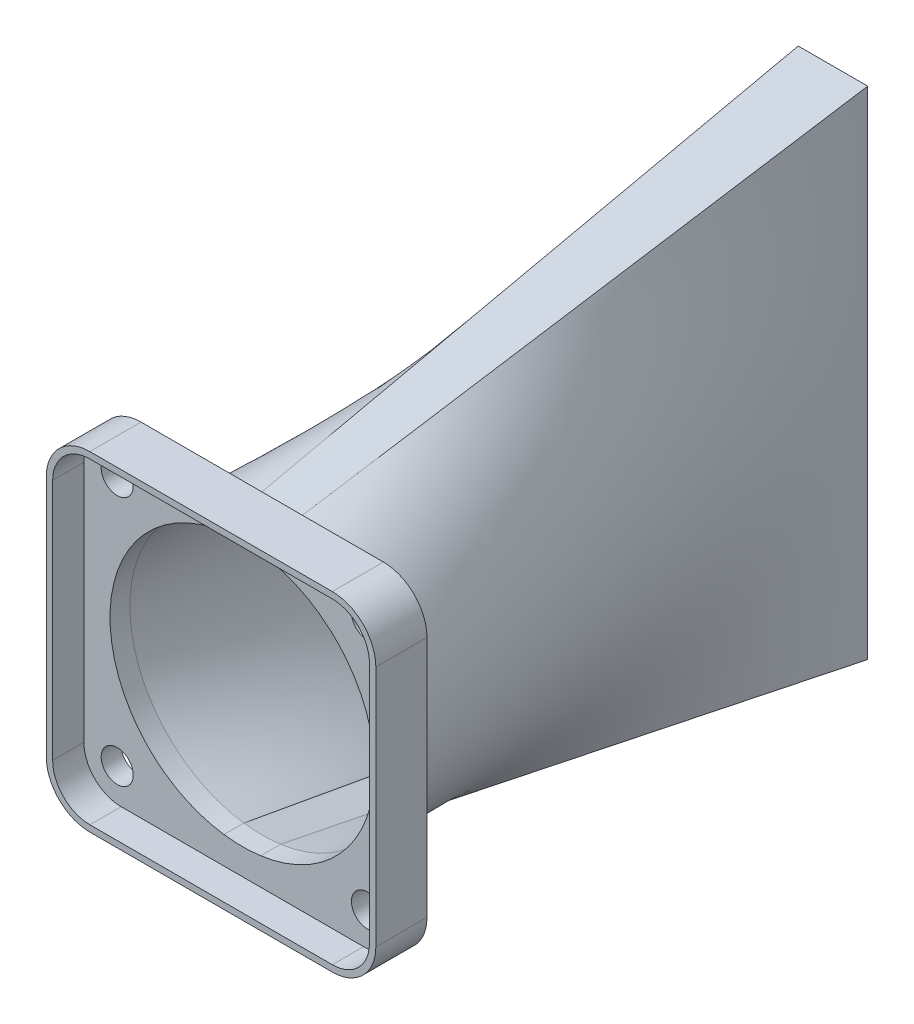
SolidWorks part; units mm, degrees
ref_plane "Front Plane" through (0, 0, 0) normal (0, 0, 1) x (1, 0, 0)
ref_plane "Top Plane" through (0, 0, 0) normal (0, 1, 0) x (1, 0, 0)
ref_plane "Right Plane" through (0, 0, 0) normal (1, 0, 0) x (0, 0, -1)
sketch "Sketch1" plane through (0, 0, 0) normal (0, 0, 1) x (1, 0, 0)
  line L8 (556.6783, -1295.6386) -> (566.1039, -1295.6386)
  line L9 (541.7911, -1271.3258) -> (541.7911, -1280.7514)
  line L10 (566.1039, -1256.4386) -> (556.6783, -1256.4386)
  line L11 (580.9911, -1280.7514) -> (580.9911, -1271.3258)
  line L18 (578.1165, -1263.5558) -> (577.608, -1264.0644)
  line L19 (580.1823, -1267.0666) -> (579.5228, -1267.2289)
  line L28 (581.1911, -1266.0843) -> (580.7911, -1266.0843)
  line L29 (580.7911, -1266.0843) -> (580.7911, -1266.2898)
  line L30 (578.1165, -1263.5558) -> (579.4254, -1262.247)
  line L31 (580.7911, -1262.8126) -> (580.7911, -1263.493)
  line L32 (580.7911, -1263.493) -> (581.1911, -1263.493)
  line L33 (581.1911, -1263.493) -> (581.1911, -1260.5386)
  line L34 (576.8911, -1256.2386) -> (545.8911, -1256.2386)
  line L35 (541.5911, -1260.5386) -> (541.5911, -1291.5386)
  line L36 (545.8911, -1295.8386) -> (576.8911, -1295.8386)
  line L37 (581.1911, -1291.5386) -> (581.1911, -1266.0843)
  arc A4 (547.4411, -1260.0386) -> (543.3411, -1260.0386) centre (545.3911, -1260.0386) ccw
  arc A5 (543.3411, -1260.0386) -> (547.4411, -1260.0386) centre (545.3911, -1260.0386) ccw
  arc A8 (579.4411, -1292.0386) -> (575.3411, -1292.0386) centre (577.3911, -1292.0386) ccw
  arc A9 (575.3411, -1292.0386) -> (579.4411, -1292.0386) centre (577.3911, -1292.0386) ccw
  arc A12 (547.4411, -1292.0386) -> (543.3411, -1292.0386) centre (545.3911, -1292.0386) ccw
  arc A13 (543.3411, -1292.0386) -> (547.4411, -1292.0386) centre (545.3911, -1292.0386) ccw
  arc A28 (579.4411, -1260.0386) -> (575.3411, -1260.0386) centre (577.3911, -1260.0386) ccw
  arc A29 (575.3411, -1260.0386) -> (579.4411, -1260.0386) centre (577.3911, -1260.0386) ccw
  arc A36 (576.8802, -1288.9405) -> (580.9911, -1280.7514) centre (561.3911, -1276.0386) ccw
  arc A37 (576.8802, -1288.9405) -> (574.2929, -1291.5278) centre (577.3911, -1292.0386) ccw
  arc A38 (566.1039, -1295.6386) -> (574.2929, -1291.5278) centre (561.3911, -1276.0386) ccw
  arc A39 (548.4892, -1291.5278) -> (556.6783, -1295.6386) centre (561.3911, -1276.0386) ccw
  arc A40 (548.4892, -1291.5278) -> (545.902, -1288.9405) centre (545.3911, -1292.0386) ccw
  arc A41 (541.7911, -1280.7514) -> (545.902, -1288.9405) centre (561.3911, -1276.0386) ccw
  arc A42 (545.902, -1263.1368) -> (541.7911, -1271.3258) centre (561.3911, -1276.0386) ccw
  arc A43 (545.902, -1263.1368) -> (548.4892, -1260.5495) centre (545.3911, -1260.0386) ccw
  arc A44 (556.6783, -1256.4386) -> (548.4892, -1260.5495) centre (561.3911, -1276.0386) ccw
  arc A45 (574.2929, -1260.5495) -> (566.1039, -1256.4386) centre (561.3911, -1276.0386) ccw
  arc A46 (574.2929, -1260.5495) -> (576.8802, -1263.1368) centre (577.3911, -1260.0386) ccw
  arc A47 (580.9911, -1271.3258) -> (579.5228, -1267.2289) centre (561.3911, -1276.0386) ccw
  arc A49 (577.608, -1264.0644) -> (576.8802, -1263.1368) centre (561.3911, -1276.0386) ccw
  arc A58 (580.1823, -1267.0666) -> (580.7911, -1266.2898) centre (579.9911, -1266.2898) ccw
  arc A62 (580.7911, -1262.8126) -> (579.4254, -1262.247) centre (579.9911, -1262.8126) ccw
  arc A63 (581.1911, -1260.5386) -> (576.8911, -1256.2386) centre (576.8911, -1260.5386) ccw
  arc A64 (545.8911, -1256.2386) -> (541.5911, -1260.5386) centre (545.8911, -1260.5386) ccw
  arc A65 (541.5911, -1291.5386) -> (545.8911, -1295.8386) centre (545.8911, -1291.5386) ccw
  arc A66 (576.8911, -1295.8386) -> (581.1911, -1291.5386) centre (576.8911, -1291.5386) ccw
extrude "Boss-Extrude1" add sketch "Sketch1" along normal blind 2.54
sketch "Sketch2" plane through (0, 0, 2.54) normal (0, 0, 1) x (1, 0, 0)
  line L0 (582.4611, -1291.5386) -> (582.4611, -1264.8143)
  line L1 (582.4611, -1264.8143) -> (579.5211, -1264.8143)
  line L2 (579.5211, -1264.8143) -> (579.5211, -1265.9215)
  line L3 (579.5211, -1265.9215) -> (577.628, -1266.3875)
  line L4 (579.7211, -1271.4788) -> (579.7211, -1280.5984)
  line L5 (565.9509, -1294.3686) -> (556.8313, -1294.3686)
  line L6 (543.0611, -1280.5984) -> (543.0611, -1271.4788)
  line L7 (556.8313, -1257.7086) -> (565.9509, -1257.7086)
  line L8 (577.421, -1266.0474) -> (579.5211, -1263.9473)
  line L9 (579.5211, -1263.9473) -> (579.5211, -1264.763)
  line L10 (579.5211, -1264.763) -> (582.4611, -1264.763)
  line L11 (582.4611, -1264.763) -> (582.4611, -1260.5386)
  line L12 (576.8911, -1254.9686) -> (545.8911, -1254.9686)
  line L13 (540.3211, -1260.5386) -> (540.3211, -1291.5386)
  line L14 (545.8911, -1297.1086) -> (576.8911, -1297.1086)
  line L15 (581.1911, -1291.5386) -> (581.1911, -1266.0843)
  line L16 (581.1911, -1266.0843) -> (580.7911, -1266.0843)
  line L17 (580.7911, -1266.0843) -> (580.7911, -1266.2898)
  line L18 (580.1823, -1267.0666) -> (579.5228, -1267.2289)
  line L19 (580.9911, -1271.3258) -> (580.9911, -1280.7514)
  line L20 (566.1039, -1295.6386) -> (556.6783, -1295.6386)
  line L21 (541.7911, -1280.7514) -> (541.7911, -1271.3258)
  line L22 (556.6783, -1256.4386) -> (566.1039, -1256.4386)
  line L23 (577.608, -1264.0644) -> (579.4254, -1262.247)
  line L24 (580.7911, -1262.8126) -> (580.7911, -1263.493)
  line L25 (580.7911, -1263.493) -> (581.1911, -1263.493)
  line L26 (581.1911, -1263.493) -> (581.1911, -1260.5386)
  line L27 (576.8911, -1256.2386) -> (545.8911, -1256.2386)
  line L28 (541.5911, -1260.5386) -> (541.5911, -1291.5386)
  line L29 (545.8911, -1295.8386) -> (576.8911, -1295.8386)
  line L30 (581.1911, -1291.5386) -> (581.1911, -1266.0843)
  line L31 (581.1911, -1266.0843) -> (580.7911, -1266.0843)
  line L32 (580.7911, -1266.0843) -> (580.7911, -1266.2898)
  line L33 (580.1823, -1267.0666) -> (579.5228, -1267.2289)
  line L34 (580.9911, -1271.3258) -> (580.9911, -1280.7514)
  line L35 (566.1039, -1295.6386) -> (556.6783, -1295.6386)
  line L36 (541.7911, -1280.7514) -> (541.7911, -1271.3258)
  line L37 (556.6783, -1256.4386) -> (566.1039, -1256.4386)
  line L38 (577.608, -1264.0644) -> (579.4254, -1262.247)
  line L39 (580.7911, -1262.8126) -> (580.7911, -1263.493)
  line L40 (580.7911, -1263.493) -> (581.1911, -1263.493)
  line L41 (581.1911, -1263.493) -> (581.1911, -1260.5386)
  line L42 (576.8911, -1256.2386) -> (545.8911, -1256.2386)
  line L43 (541.5911, -1260.5386) -> (541.5911, -1291.5386)
  line L44 (545.8911, -1295.8386) -> (576.8911, -1295.8386)
  line L45 (581.1911, -1266.0843) -> (582.4611, -1266.0843)
  line L46 (581.1911, -1263.493) -> (582.4611, -1263.493)
  arc A0 (579.5211, -1265.9215) -> (579.5211, -1265.9215) centre (579.5211, -1265.9215) ccw
  arc A1 (579.7211, -1271.4788) -> (577.628, -1266.3875) centre (561.3911, -1276.0386) ccw
  arc A2 (576.1704, -1287.8009) -> (579.7211, -1280.5984) centre (561.3911, -1276.0386) ccw
  arc A3 (576.1704, -1287.8009) -> (573.1534, -1290.818) centre (577.3911, -1292.0386) ccw
  arc A4 (565.9509, -1294.3686) -> (573.1534, -1290.818) centre (561.3911, -1276.0386) ccw
  arc A5 (549.6288, -1290.818) -> (556.8313, -1294.3686) centre (561.3911, -1276.0386) ccw
  arc A6 (549.6288, -1290.818) -> (546.6117, -1287.8009) centre (545.3911, -1292.0386) ccw
  arc A7 (543.0611, -1280.5984) -> (546.6117, -1287.8009) centre (561.3911, -1276.0386) ccw
  arc A8 (546.6117, -1264.2763) -> (543.0611, -1271.4788) centre (561.3911, -1276.0386) ccw
  arc A9 (546.6117, -1264.2763) -> (549.6288, -1261.2593) centre (545.3911, -1260.0386) ccw
  arc A10 (556.8313, -1257.7086) -> (549.6288, -1261.2593) centre (561.3911, -1276.0386) ccw
  arc A11 (573.1534, -1261.2593) -> (565.9509, -1257.7086) centre (561.3911, -1276.0386) ccw
  arc A12 (573.1534, -1261.2593) -> (576.1704, -1264.2763) centre (577.3911, -1260.0386) ccw
  arc A13 (577.421, -1266.0474) -> (576.1704, -1264.2763) centre (561.3911, -1276.0386) ccw
  arc A14 (579.5211, -1263.9473) -> (579.5211, -1263.9473) centre (579.5211, -1263.9473) ccw
  arc A15 (582.4611, -1260.5386) -> (576.8911, -1254.9686) centre (576.8911, -1260.5386) ccw
  arc A16 (545.8911, -1254.9686) -> (540.3211, -1260.5386) centre (545.8911, -1260.5386) ccw
  arc A17 (540.3211, -1291.5386) -> (545.8911, -1297.1086) centre (545.8911, -1291.5386) ccw
  arc A18 (576.8911, -1297.1086) -> (582.4611, -1291.5386) centre (576.8911, -1291.5386) ccw
  arc A19 (580.1823, -1267.0666) -> (580.7911, -1266.2898) centre (579.9911, -1266.2898) ccw
  arc A20 (580.9911, -1271.3258) -> (579.5228, -1267.2289) centre (561.3911, -1276.0386) ccw
  arc A21 (576.8802, -1288.9405) -> (580.9911, -1280.7514) centre (561.3911, -1276.0386) ccw
  arc A22 (576.8802, -1288.9405) -> (574.2929, -1291.5278) centre (577.3911, -1292.0386) ccw
  arc A23 (566.1039, -1295.6386) -> (574.2929, -1291.5278) centre (561.3911, -1276.0386) ccw
  arc A24 (548.4892, -1291.5278) -> (556.6783, -1295.6386) centre (561.3911, -1276.0386) ccw
  arc A25 (548.4892, -1291.5278) -> (545.902, -1288.9405) centre (545.3911, -1292.0386) ccw
  arc A26 (541.7911, -1280.7514) -> (545.902, -1288.9405) centre (561.3911, -1276.0386) ccw
  arc A27 (545.902, -1263.1368) -> (541.7911, -1271.3258) centre (561.3911, -1276.0386) ccw
  arc A28 (545.902, -1263.1368) -> (548.4892, -1260.5495) centre (545.3911, -1260.0386) ccw
  arc A29 (556.6783, -1256.4386) -> (548.4892, -1260.5495) centre (561.3911, -1276.0386) ccw
  arc A30 (574.2929, -1260.5495) -> (566.1039, -1256.4386) centre (561.3911, -1276.0386) ccw
  arc A31 (574.2929, -1260.5495) -> (576.8802, -1263.1368) centre (577.3911, -1260.0386) ccw
  arc A32 (577.608, -1264.0644) -> (576.8802, -1263.1368) centre (561.3911, -1276.0386) ccw
  arc A33 (580.7911, -1262.8126) -> (579.4254, -1262.247) centre (579.9911, -1262.8126) ccw
  arc A34 (581.1911, -1260.5386) -> (576.8911, -1256.2386) centre (576.8911, -1260.5386) ccw
  arc A35 (545.8911, -1256.2386) -> (541.5911, -1260.5386) centre (545.8911, -1260.5386) ccw
  arc A36 (541.5911, -1291.5386) -> (545.8911, -1295.8386) centre (545.8911, -1291.5386) ccw
  arc A37 (576.8911, -1295.8386) -> (581.1911, -1291.5386) centre (576.8911, -1291.5386) ccw
  arc A38 (580.1823, -1267.0666) -> (580.7911, -1266.2898) centre (579.9911, -1266.2898) ccw
  arc A39 (580.9911, -1271.3258) -> (579.5228, -1267.2289) centre (561.3911, -1276.0386) ccw
  arc A40 (576.8802, -1288.9405) -> (580.9911, -1280.7514) centre (561.3911, -1276.0386) ccw
  arc A41 (576.8802, -1288.9405) -> (574.2929, -1291.5278) centre (577.3911, -1292.0386) ccw
  arc A42 (566.1039, -1295.6386) -> (574.2929, -1291.5278) centre (561.3911, -1276.0386) ccw
  arc A43 (548.4892, -1291.5278) -> (556.6783, -1295.6386) centre (561.3911, -1276.0386) ccw
  arc A44 (548.4892, -1291.5278) -> (545.902, -1288.9405) centre (545.3911, -1292.0386) ccw
  arc A45 (541.7911, -1280.7514) -> (545.902, -1288.9405) centre (561.3911, -1276.0386) ccw
  arc A46 (545.902, -1263.1368) -> (541.7911, -1271.3258) centre (561.3911, -1276.0386) ccw
  arc A47 (545.902, -1263.1368) -> (548.4892, -1260.5495) centre (545.3911, -1260.0386) ccw
  arc A48 (556.6783, -1256.4386) -> (548.4892, -1260.5495) centre (561.3911, -1276.0386) ccw
  arc A49 (574.2929, -1260.5495) -> (566.1039, -1256.4386) centre (561.3911, -1276.0386) ccw
  arc A50 (574.2929, -1260.5495) -> (576.8802, -1263.1368) centre (577.3911, -1260.0386) ccw
  arc A51 (577.608, -1264.0644) -> (576.8802, -1263.1368) centre (561.3911, -1276.0386) ccw
  arc A52 (580.7911, -1262.8126) -> (579.4254, -1262.247) centre (579.9911, -1262.8126) ccw
  arc A53 (581.1911, -1260.5386) -> (576.8911, -1256.2386) centre (576.8911, -1260.5386) ccw
  arc A54 (545.8911, -1256.2386) -> (541.5911, -1260.5386) centre (545.8911, -1260.5386) ccw
  arc A55 (541.5911, -1291.5386) -> (545.8911, -1295.8386) centre (545.8911, -1291.5386) ccw
  arc A56 (576.8911, -1295.8386) -> (581.1911, -1291.5386) centre (576.8911, -1291.5386) ccw
  dimension "D1" = 0
  dimension "D2" = 1.27
extrude "Boss-Extrude2" add sketch "Sketch2" against normal up to vertex contours L14 A18 L0 L45 L46 L11 A15 L12 A16 L13 A17 M37 M70 M69 M68 M67 M66 M65 M64 M63
sketch "Sketch3" plane through (0, 0, 2.54) normal (0, 0, 1) x (1, 0, 0)
  line L0 (576.8911, -1291.5386) -> (574.2727, -1288.9203)
  line L15 (582.4611, -1291.5386) -> (582.4611, -1266.0843)
  line L16 (582.4611, -1266.0843) -> (580.7911, -1266.0843)
  line L17 (580.7911, -1266.0843) -> (580.7911, -1266.2898)
  line L18 (580.1823, -1267.0666) -> (579.5228, -1267.2289)
  line L19 (580.9911, -1271.3258) -> (580.9911, -1280.7514)
  line L20 (566.1039, -1295.6386) -> (556.6783, -1295.6386)
  line L21 (541.7911, -1280.7514) -> (541.7911, -1271.3258)
  line L22 (556.6783, -1256.4386) -> (566.1039, -1256.4386)
  line L23 (577.608, -1264.0644) -> (579.4254, -1262.247)
  line L24 (580.7911, -1262.8126) -> (580.7911, -1263.493)
  line L25 (580.7911, -1263.493) -> (582.4611, -1263.493)
  line L26 (582.4611, -1263.493) -> (582.4611, -1260.5386)
  line L27 (576.8911, -1254.9686) -> (545.8911, -1254.9686)
  line L28 (540.3211, -1260.5386) -> (540.3211, -1291.5386)
  line L29 (545.8911, -1297.1086) -> (576.8911, -1297.1086)
  line L30 (582.4611, -1291.5386) -> (582.4611, -1266.0843)
  line L31 (582.4611, -1266.0843) -> (580.7911, -1266.0843)
  line L32 (580.7911, -1266.0843) -> (580.7911, -1266.2898)
  line L33 (580.1823, -1267.0666) -> (579.5228, -1267.2289)
  line L34 (580.9911, -1271.3258) -> (580.9911, -1280.7514)
  line L35 (566.1039, -1295.6386) -> (556.6783, -1295.6386)
  line L36 (541.7911, -1280.7514) -> (541.7911, -1271.3258)
  line L37 (556.6783, -1256.4386) -> (566.1039, -1256.4386)
  line L38 (577.608, -1264.0644) -> (579.4254, -1262.247)
  line L39 (580.7911, -1262.8126) -> (580.7911, -1263.493)
  line L40 (580.7911, -1263.493) -> (582.4611, -1263.493)
  line L41 (582.4611, -1263.493) -> (582.4611, -1260.5386)
  line L42 (576.8911, -1254.9686) -> (545.8911, -1254.9686)
  line L43 (540.3211, -1260.5386) -> (540.3211, -1291.5386)
  line L44 (545.8911, -1297.1086) -> (576.8911, -1297.1086)
  arc A0 (574.2929, -1260.5495) -> (576.8802, -1263.1368) centre (577.3911, -1260.0386) ccw construction
  circle A1 centre (545.3911, -1260.0386) radius 2.05
  circle A2 centre (545.3911, -1260.0386) radius 2.05
  circle A3 centre (577.3911, -1292.0386) radius 2.05
  circle A4 centre (577.3911, -1292.0386) radius 2.05
  circle A5 centre (545.3911, -1292.0386) radius 2.05
  circle A6 centre (545.3911, -1292.0386) radius 2.05
  circle A7 centre (577.3911, -1260.0386) radius 2.05
  circle A8 centre (577.3911, -1260.0386) radius 2.05
  arc A9 (545.902, -1263.1368) -> (548.4892, -1260.5495) centre (545.3911, -1260.0386) ccw construction
  arc A10 (548.4892, -1291.5278) -> (545.902, -1288.9405) centre (545.3911, -1292.0386) ccw construction
  arc A11 (576.8802, -1288.9405) -> (574.2929, -1291.5278) centre (577.3911, -1292.0386) ccw construction
  arc A12 (574.2929, -1260.5495) -> (576.8802, -1263.1368) centre (577.3911, -1260.0386) ccw
  arc A13 (545.902, -1263.1368) -> (548.4892, -1260.5495) centre (545.3911, -1260.0386) ccw
  arc A14 (548.4892, -1291.5278) -> (545.902, -1288.9405) centre (545.3911, -1292.0386) ccw
  arc A15 (576.8802, -1288.9405) -> (574.2929, -1291.5278) centre (577.3911, -1292.0386) ccw
  arc A16 (576.6736, -1287.6874) -> (573.0398, -1291.3211) centre (577.3911, -1292.0386) ccw construction
  arc A17 (549.7423, -1291.3211) -> (546.1086, -1287.6874) centre (545.3911, -1292.0386) ccw construction
  arc A18 (546.1086, -1264.3899) -> (549.7423, -1260.7561) centre (545.3911, -1260.0386) ccw construction
  arc A19 (573.0398, -1260.7561) -> (576.6736, -1264.3899) centre (577.3911, -1260.0386) ccw construction
  circle A20 centre (561.3911, -1276.0386) radius 18.2174
  arc A22 (580.9911, -1271.3258) -> (576.8802, -1263.1368) centre (561.3911, -1276.0386) ccw
  arc A39 (580.1823, -1267.0666) -> (580.7911, -1266.2898) centre (579.9911, -1266.2898) ccw
  arc A40 (580.9911, -1271.3258) -> (579.5228, -1267.2289) centre (561.3911, -1276.0386) ccw
  arc A41 (576.8802, -1288.9405) -> (580.9911, -1280.7514) centre (561.3911, -1276.0386) ccw
  arc A42 (576.8802, -1288.9405) -> (574.2929, -1291.5278) centre (577.3911, -1292.0386) ccw
  arc A43 (566.1039, -1295.6386) -> (574.2929, -1291.5278) centre (561.3911, -1276.0386) ccw
  arc A44 (548.4892, -1291.5278) -> (556.6783, -1295.6386) centre (561.3911, -1276.0386) ccw
  arc A45 (548.4892, -1291.5278) -> (545.902, -1288.9405) centre (545.3911, -1292.0386) ccw
  arc A46 (541.7911, -1280.7514) -> (545.902, -1288.9405) centre (561.3911, -1276.0386) ccw
  arc A47 (545.902, -1263.1368) -> (541.7911, -1271.3258) centre (561.3911, -1276.0386) ccw
  arc A48 (545.902, -1263.1368) -> (548.4892, -1260.5495) centre (545.3911, -1260.0386) ccw
  arc A49 (556.6783, -1256.4386) -> (548.4892, -1260.5495) centre (561.3911, -1276.0386) ccw
  arc A50 (574.2929, -1260.5495) -> (566.1039, -1256.4386) centre (561.3911, -1276.0386) ccw
  arc A51 (574.2929, -1260.5495) -> (576.8802, -1263.1368) centre (577.3911, -1260.0386) ccw
  arc A52 (577.608, -1264.0644) -> (576.8802, -1263.1368) centre (561.3911, -1276.0386) ccw
  arc A53 (580.7911, -1262.8126) -> (579.4254, -1262.247) centre (579.9911, -1262.8126) ccw
  arc A54 (582.4611, -1260.5386) -> (576.8911, -1254.9686) centre (576.8911, -1260.5386) ccw
  arc A55 (545.8911, -1254.9686) -> (540.3211, -1260.5386) centre (545.8911, -1260.5386) ccw
  arc A56 (540.3211, -1291.5386) -> (545.8911, -1297.1086) centre (545.8911, -1291.5386) ccw
  arc A57 (576.8911, -1297.1086) -> (582.4611, -1291.5386) centre (576.8911, -1291.5386) ccw
  arc A58 (580.1823, -1267.0666) -> (580.7911, -1266.2898) centre (579.9911, -1266.2898) ccw
  arc A59 (580.9911, -1271.3258) -> (579.5228, -1267.2289) centre (561.3911, -1276.0386) ccw
  arc A60 (576.8802, -1288.9405) -> (580.9911, -1280.7514) centre (561.3911, -1276.0386) ccw
  arc A61 (576.8802, -1288.9405) -> (574.2929, -1291.5278) centre (577.3911, -1292.0386) ccw
  arc A62 (566.1039, -1295.6386) -> (574.2929, -1291.5278) centre (561.3911, -1276.0386) ccw
  arc A63 (548.4892, -1291.5278) -> (556.6783, -1295.6386) centre (561.3911, -1276.0386) ccw
  arc A64 (548.4892, -1291.5278) -> (545.902, -1288.9405) centre (545.3911, -1292.0386) ccw
  arc A65 (541.7911, -1280.7514) -> (545.902, -1288.9405) centre (561.3911, -1276.0386) ccw
  arc A66 (545.902, -1263.1368) -> (541.7911, -1271.3258) centre (561.3911, -1276.0386) ccw
  arc A67 (545.902, -1263.1368) -> (548.4892, -1260.5495) centre (545.3911, -1260.0386) ccw
  arc A68 (556.6783, -1256.4386) -> (548.4892, -1260.5495) centre (561.3911, -1276.0386) ccw
  arc A69 (574.2929, -1260.5495) -> (566.1039, -1256.4386) centre (561.3911, -1276.0386) ccw
  arc A70 (574.2929, -1260.5495) -> (576.8802, -1263.1368) centre (577.3911, -1260.0386) ccw
  arc A71 (577.608, -1264.0644) -> (576.8802, -1263.1368) centre (561.3911, -1276.0386) ccw
  arc A72 (580.7911, -1262.8126) -> (579.4254, -1262.247) centre (579.9911, -1262.8126) ccw
  arc A73 (582.4611, -1260.5386) -> (576.8911, -1254.9686) centre (576.8911, -1260.5386) ccw
  arc A74 (545.8911, -1254.9686) -> (540.3211, -1260.5386) centre (545.8911, -1260.5386) ccw
  arc A75 (540.3211, -1291.5386) -> (545.8911, -1297.1086) centre (545.8911, -1291.5386) ccw
  arc A76 (576.8911, -1297.1086) -> (582.4611, -1291.5386) centre (576.8911, -1291.5386) ccw
  dimension "D1" = 0
  dimension "D2" = 0
  dimension "D3" = 0
  dimension "D4" = 0
  dimension "D5" = 1.27
  dimension "D6" = 0
extrude "Boss-Extrude3" add sketch "Sketch3" against normal up to vertex
ref_plane "Plane1" through (0, -1276.0386, 0) normal (0, -1, 0) x (-1, 0, 0)
ref_plane "Plane5" through (616.2022, 0, 0) normal (-1, 0, 0) x (0, 0, 1)
sketch "Sketch4" plane through (0, 0, 0) normal (0, 0, -1) x (-1, 0, 0)
  circle A0 centre (-561.3911, -1276.0386) radius 18.2174 construction
  circle A1 centre (-561.3911, -1276.0386) radius 18.2174
ref_plane "Plane6" through (0, 0, -72.9848) normal (0, 0, 1) x (1, 0, 0)
sketch "Sketch7" plane through (0, 0, -72.9848) normal (0, 0, 1) x (1, 0, 0)
  line L1 (556.9461, -1244.2886) -> (565.8361, -1244.2886)
  line L2 (556.9461, -1244.2886) -> (556.9461, -1307.7886)
  line L3 (556.9461, -1307.7886) -> (565.8361, -1307.7886)
  line L4 (565.8361, -1244.2886) -> (565.8361, -1307.7886)
  line L5 (556.9461, -1244.2886) -> (565.8361, -1307.7886) construction
  line L6 (556.9461, -1307.7886) -> (565.8361, -1244.2886) construction
  circle A0 centre (561.3911, -1276.0386) radius 18.2174 construction
  circle A1 centre (561.3911, -1276.0386) radius 18.2174 construction
  dimension "D1" = 63.5
  dimension "D2" = 8.89
loft "Loft-Thin1" add profiles "Sketch7", "Sketch4" parameters "D1"=1.27
sketch "Sketch8" plane through (0, 0, 2.54) normal (0, 0, 1) x (1, 0, 0)
  line L3 (576.8911, -1256.0386) -> (545.8911, -1256.0386)
  line L4 (545.8911, -1296.0386) -> (576.8911, -1296.0386)
  line L5 (541.3911, -1260.5386) -> (541.3911, -1291.5386)
  line L10 (581.3911, -1263.493) -> (581.3911, -1260.5386)
  line L11 (582.4611, -1291.5386) -> (582.4611, -1266.0843)
  line L12 (582.4611, -1266.0843) -> (580.7911, -1266.0843)
  line L13 (580.7911, -1266.0843) -> (580.7911, -1266.2898)
  line L14 (580.1823, -1267.0666) -> (579.5228, -1267.2289)
  line L15 (577.608, -1264.0644) -> (579.4254, -1262.247)
  line L16 (580.7911, -1262.8126) -> (580.7911, -1263.493)
  line L17 (580.7911, -1263.493) -> (582.4611, -1263.493)
  line L18 (582.4611, -1263.493) -> (582.4611, -1260.5386)
  line L19 (576.8911, -1254.9686) -> (545.8911, -1254.9686)
  line L20 (540.3211, -1260.5386) -> (540.3211, -1291.5386)
  line L21 (545.8911, -1297.1086) -> (576.8911, -1297.1086)
  line L22 (582.4611, -1291.5386) -> (582.4611, -1266.0843)
  line L23 (582.4611, -1266.0843) -> (581.3911, -1266.0843)
  line L28 (581.3911, -1263.493) -> (582.4611, -1263.493)
  line L29 (582.4611, -1263.493) -> (582.4611, -1260.5386)
  line L30 (576.8911, -1254.9686) -> (545.8911, -1254.9686)
  line L31 (540.3211, -1260.5386) -> (540.3211, -1291.5386)
  line L32 (545.8911, -1297.1086) -> (576.8911, -1297.1086)
  line L33 (576.8911, -1255.7846) -> (545.8911, -1255.7846)
  line L34 (581.3911, -1271.2386) -> (581.3911, -1268.1386)
  line L35 (581.3911, -1291.5386) -> (581.3911, -1271.2386)
  line L36 (581.3911, -1268.1386) -> (581.3911, -1266.0843)
  line L37 (541.1371, -1260.5386) -> (541.1371, -1291.5386)
  line L38 (545.8911, -1296.2926) -> (576.8911, -1296.2926)
  line L39 (581.6451, -1291.5386) -> (581.6451, -1271.2386)
  line L40 (581.6451, -1271.2386) -> (581.6451, -1268.1386)
  line L41 (581.6451, -1268.1386) -> (581.6451, -1266.3383)
  line L43 (582.2071, -1291.5386) -> (582.2071, -1266.3383)
  line L44 (545.8911, -1296.8546) -> (576.8911, -1296.8546)
  line L45 (540.5751, -1260.5386) -> (540.5751, -1291.5386)
  line L46 (576.8911, -1255.2226) -> (545.8911, -1255.2226)
  line L47 (582.2071, -1263.239) -> (582.2071, -1260.5386)
  line L49 (581.6451, -1263.239) -> (581.6451, -1260.5386)
  line L50 (581.6451, -1263.239) -> (581.6451, -1263.493)
  line L51 (582.2071, -1263.239) -> (582.2071, -1263.493)
  line L52 (581.6451, -1266.3383) -> (581.6451, -1266.0843)
  line L53 (582.2071, -1266.3383) -> (582.2071, -1266.0843)
  line L61 (581.6451, -1263.239) -> (582.2071, -1263.239) construction
  line L62 (582.2071, -1266.3383) -> (581.6451, -1266.3383) construction
  arc A4 (581.3911, -1260.5386) -> (576.8911, -1256.0386) centre (576.8911, -1260.5386) ccw
  arc A5 (545.8911, -1256.0386) -> (541.3911, -1260.5386) centre (545.8911, -1260.5386) ccw
  arc A6 (576.8911, -1296.0386) -> (581.3911, -1291.5386) centre (576.8911, -1291.5386) ccw
  arc A7 (580.1823, -1267.0666) -> (580.7911, -1266.2898) centre (579.9911, -1266.2898) ccw
  arc A8 (579.5228, -1267.2289) -> (577.608, -1264.0644) centre (561.3911, -1276.0386) ccw
  arc A9 (580.7911, -1262.8126) -> (579.4254, -1262.247) centre (579.9911, -1262.8126) ccw
  arc A10 (582.4611, -1260.5386) -> (576.8911, -1254.9686) centre (576.8911, -1260.5386) ccw
  arc A11 (545.8911, -1254.9686) -> (540.3211, -1260.5386) centre (545.8911, -1260.5386) ccw
  arc A12 (540.3211, -1291.5386) -> (545.8911, -1297.1086) centre (545.8911, -1291.5386) ccw
  arc A13 (576.8911, -1297.1086) -> (582.4611, -1291.5386) centre (576.8911, -1291.5386) ccw
  arc A17 (582.4611, -1260.5386) -> (576.8911, -1254.9686) centre (576.8911, -1260.5386) ccw
  arc A18 (545.8911, -1254.9686) -> (540.3211, -1260.5386) centre (545.8911, -1260.5386) ccw
  arc A19 (540.3211, -1291.5386) -> (545.8911, -1297.1086) centre (545.8911, -1291.5386) ccw
  arc A20 (576.8911, -1297.1086) -> (582.4611, -1291.5386) centre (576.8911, -1291.5386) ccw
  arc A21 (541.3911, -1291.5386) -> (545.8911, -1296.0386) centre (545.8911, -1291.5386) ccw
  arc A22 (581.6451, -1260.5386) -> (576.8911, -1255.7846) centre (576.8911, -1260.5386) ccw
  arc A23 (545.8911, -1255.7846) -> (541.1371, -1260.5386) centre (545.8911, -1260.5386) ccw
  arc A24 (541.1371, -1291.5386) -> (545.8911, -1296.2926) centre (545.8911, -1291.5386) ccw
  arc A25 (576.8911, -1296.2926) -> (581.6451, -1291.5386) centre (576.8911, -1291.5386) ccw
  arc A26 (576.8911, -1296.8546) -> (582.2071, -1291.5386) centre (576.8911, -1291.5386) ccw
  arc A27 (540.5751, -1291.5386) -> (545.8911, -1296.8546) centre (545.8911, -1291.5386) ccw
  arc A28 (545.8911, -1255.2226) -> (540.5751, -1260.5386) centre (545.8911, -1260.5386) ccw
  arc A29 (582.2071, -1260.5386) -> (576.8911, -1255.2226) centre (576.8911, -1260.5386) ccw
  dimension "D1" = 0
  dimension "D2" = 0.254
extrude "Boss-Extrude5" add sketch "Sketch8" along normal up to vertex contours L47 A29 L46 A28 L45 A27 L44 A26 L43 L53 L23 L52 L41 L40 L39 A25 L38 A24 L37 A23 L33 A22 L49 L50 L28 L51 | A29 L47 L51 L53 L43 A26 L44 A27 L45 A28 L46 M28 M29 M30 M31 M32 M33 M34 M35 M36 M19 M20
sketch "Sketch9" plane through (0, 0, 0) normal (0, 0, -1) x (-1, 0, 0)
  line L0 (-582.4611, -1266.0843) -> (-582.4611, -1263.493)
  line L11 (-580.7911, -1266.0843) -> (-582.4611, -1266.0843)
  line L12 (-582.4611, -1266.0843) -> (-582.4611, -1291.5386)
  line L13 (-576.8911, -1297.1086) -> (-545.8911, -1297.1086)
  line L14 (-540.3211, -1291.5386) -> (-540.3211, -1260.5386)
  line L15 (-545.8911, -1254.9686) -> (-576.8911, -1254.9686)
  line L16 (-582.4611, -1260.5386) -> (-582.4611, -1263.493)
  line L17 (-582.4611, -1263.493) -> (-580.7911, -1263.493)
  line L18 (-580.7911, -1263.493) -> (-580.7911, -1262.8126)
  line L19 (-579.4254, -1262.247) -> (-577.608, -1264.0644)
  line L20 (-579.5228, -1267.2289) -> (-580.1823, -1267.0666)
  line L21 (-580.7911, -1266.2898) -> (-580.7911, -1266.0843)
  line L22 (-580.7911, -1266.0843) -> (-582.4611, -1266.0843)
  line L23 (-582.4611, -1266.0843) -> (-582.4611, -1291.5386)
  line L24 (-576.8911, -1297.1086) -> (-545.8911, -1297.1086)
  line L25 (-540.3211, -1291.5386) -> (-540.3211, -1260.5386)
  line L26 (-545.8911, -1254.9686) -> (-576.8911, -1254.9686)
  line L27 (-582.4611, -1260.5386) -> (-582.4611, -1263.493)
  line L28 (-582.4611, -1263.493) -> (-580.7911, -1263.493)
  line L29 (-580.7911, -1263.493) -> (-580.7911, -1262.8126)
  line L30 (-579.4254, -1262.247) -> (-577.608, -1264.0644)
  line L31 (-579.5228, -1267.2289) -> (-580.1823, -1267.0666)
  line L32 (-580.7911, -1266.2898) -> (-580.7911, -1266.0843)
  arc A7 (-582.4611, -1291.5386) -> (-576.8911, -1297.1086) centre (-576.8911, -1291.5386) ccw
  arc A8 (-545.8911, -1297.1086) -> (-540.3211, -1291.5386) centre (-545.8911, -1291.5386) ccw
  arc A9 (-540.3211, -1260.5386) -> (-545.8911, -1254.9686) centre (-545.8911, -1260.5386) ccw
  arc A10 (-576.8911, -1254.9686) -> (-582.4611, -1260.5386) centre (-576.8911, -1260.5386) ccw
  arc A11 (-579.4254, -1262.247) -> (-580.7911, -1262.8126) centre (-579.9911, -1262.8126) ccw
  arc A12 (-577.608, -1264.0644) -> (-579.5228, -1267.2289) centre (-561.3911, -1276.0386) ccw
  arc A13 (-580.7911, -1266.2898) -> (-580.1823, -1267.0666) centre (-579.9911, -1266.2898) ccw
  arc A14 (-582.4611, -1291.5386) -> (-576.8911, -1297.1086) centre (-576.8911, -1291.5386) ccw
  arc A15 (-545.8911, -1297.1086) -> (-540.3211, -1291.5386) centre (-545.8911, -1291.5386) ccw
  arc A16 (-540.3211, -1260.5386) -> (-545.8911, -1254.9686) centre (-545.8911, -1260.5386) ccw
  arc A17 (-576.8911, -1254.9686) -> (-582.4611, -1260.5386) centre (-576.8911, -1260.5386) ccw
  arc A18 (-579.4254, -1262.247) -> (-580.7911, -1262.8126) centre (-579.9911, -1262.8126) ccw
  arc A19 (-577.608, -1264.0644) -> (-579.5228, -1267.2289) centre (-561.3911, -1276.0386) ccw
  arc A20 (-580.7911, -1266.2898) -> (-580.1823, -1267.0666) centre (-579.9911, -1266.2898) ccw
  dimension "D1" = 0
extrude "Boss-Extrude6" add sketch "Sketch9" against normal up to surface (2.54 mm away) contours L0 M20 M37 M36 M35 M34 M33 M32 M31 M30
sketch "Sketch10" plane through (0, 0, 6.54) normal (0, 0, 1) x (1, 0, 0)
  line L0 (582.4611, -1266.0843) -> (581.6451, -1266.0843) construction
  line L1 (581.6451, -1263.493) -> (582.4611, -1263.493) construction
  line L2 (582.4611, -1266.0843) -> (581.6451, -1266.0843)
  line L3 (581.6451, -1263.493) -> (582.4611, -1263.493)
  line L4 (582.4611, -1266.0843) -> (582.4611, -1263.493)
  line L5 (581.6451, -1263.493) -> (581.6451, -1266.0843)
extrude "Boss-Extrude7" add sketch "Sketch10" against normal up to surface (4 mm away)
sketch "Sketch11" plane through (0, 0, 0) normal (0, 0, 1) x (1, 0, 0)
  arc A4 (563.9169, -1294.0801) -> (563.9169, -1257.9972) centre (561.3911, -1276.0386) ccw
  arc A5 (563.9169, -1257.9972) -> (558.8653, -1257.9972) centre (561.3911, -1276.0386) ccw
  arc A6 (558.8653, -1257.9972) -> (558.8653, -1294.0801) centre (561.3911, -1276.0386) ccw
  arc A7 (558.8653, -1294.0801) -> (563.9169, -1294.0801) centre (561.3911, -1276.0386) ccw
  arc A8 (563.9169, -1294.0801) -> (563.9169, -1257.9972) centre (561.3911, -1276.0386) ccw
  arc A9 (563.9169, -1257.9972) -> (558.8653, -1257.9972) centre (561.3911, -1276.0386) ccw
  arc A10 (558.8653, -1257.9972) -> (558.8653, -1294.0801) centre (561.3911, -1276.0386) ccw
  arc A11 (558.8653, -1294.0801) -> (563.9169, -1294.0801) centre (561.3911, -1276.0386) ccw
  spline S0 degree 3 poles (999.9123, -4217.0926) (437.043, -1831.0747) (480.6246, -1259.1132) (642.2146, -1259.1142) (683.4606, -1831.6639) (596.7533, -4255.257) knots -50.817231 -50.817231 -50.817231 -50.817231 0.5 0.5 51.853304 51.853304 51.853304 51.853304 only from (559.0415, -1259.2777) to (563.7407, -1259.2777) construction
  spline S1 degree 3 poles (-540.9439, -4044.6401) (268.6787, -1704.8728) (494.43, -1236.4373) (567.1675, -1260.1048) (567.6387, -1260.282) (568.5673, -1260.6801) (569.027, -1260.9023) (570.3669, -1261.6273) (571.2048, -1262.185) (572.3815, -1263.1292) (572.7603, -1263.462) (573.4904, -1264.1646) (573.8426, -1264.5357) (574.8373, -1265.6832) (575.425, -1266.4993) (576.1958, -1267.7984) (576.4342, -1268.244) (576.8728, -1269.161) (577.0716, -1269.6304) (577.5997, -1271.05) (577.8657, -1272.0193) (578.1343, -1273.508) (578.2022, -1274.0105) (578.2933, -1275.0253) (578.316, -1275.531) (578.3163, -1277.0428) (578.2274, -1278.0439) (577.9608, -1279.5354) (577.8486, -1280.0332) (577.5807, -1281.0131) (577.4258, -1281.4939) (576.9, -1282.9094) (576.4678, -1283.8172) (575.6951, -1285.1243) (575.4153, -1285.5527) (574.8234, -1286.375) (574.5107, -1286.7704) (573.5234, -1287.9107) (572.8002, -1288.6101) (571.6144, -1289.5646) (571.2021, -1289.8667) (570.3605, -1290.4267) (569.9292, -1290.6863) (568.6039, -1291.405) (567.6791, -1291.8045) (490.6885, -1316.9714) (265.7473, -787.5954) (2635.8817, 802.6349) knots -4.662586 -4.662586 -4.662586 -4.662586 0.0625 0.0625 0.09375 0.09375 0.125 0.125 0.1875 0.1875 0.21875 0.21875 0.25 0.25 0.3125 0.3125 0.34375 0.34375 0.375 0.375 0.4375 0.4375 0.46875 0.46875 0.5 0.5 0.5625 0.5625 0.59375 0.59375 0.625 0.625 0.6875 0.6875 0.71875 0.71875 0.75 0.75 0.8125 0.8125 0.84375 0.84375 0.875 0.875 0.9375 0.9375 5.846445 5.846445 5.846445 5.846445 only from (563.7407, -1259.2777) to (563.7407, -1292.7995) construction
  spline S2 degree 3 poles (122.8699, 1665.0153) (685.7391, -721.0025) (642.1576, -1292.9641) (480.5676, -1292.963) (439.3216, -720.4133) (526.0289, 1703.1797) knots -50.817231 -50.817231 -50.817231 -50.817231 0.5 0.5 51.853304 51.853304 51.853304 51.853304 only from (563.7407, -1292.7995) to (559.0415, -1292.7995) construction
  spline S3 degree 3 poles (1663.7603, 1492.6614) (854.1097, -847.1915) (628.3531, -1315.6402) (555.6147, -1291.9724) (555.1435, -1291.7953) (554.2149, -1291.3972) (553.7552, -1291.175) (552.4153, -1290.45) (551.5774, -1289.8923) (550.4006, -1288.9481) (550.0218, -1288.6153) (549.2918, -1287.9127) (548.9396, -1287.5415) (547.9448, -1286.3941) (547.3571, -1285.578) (546.5864, -1284.2788) (546.3479, -1283.8333) (545.9093, -1282.9162) (545.7106, -1282.4468) (545.1825, -1281.0272) (544.9164, -1280.0579) (544.6479, -1278.5692) (544.58, -1278.0667) (544.4889, -1277.0519) (544.4662, -1276.5463) (544.4659, -1275.0344) (544.5548, -1274.0333) (544.8214, -1272.5418) (544.9336, -1272.0441) (545.2014, -1271.0641) (545.3563, -1270.5834) (545.8821, -1269.1679) (546.3144, -1268.2601) (547.0871, -1266.953) (547.3668, -1266.5246) (547.9587, -1265.7023) (548.2715, -1265.3069) (549.2588, -1264.1665) (549.982, -1263.4671) (551.1678, -1262.5126) (551.58, -1262.2106) (552.4216, -1261.6506) (552.853, -1261.391) (554.1783, -1260.6723) (555.1031, -1260.2727) (632.0933, -1235.1059) (857.034, -1764.4772) (-1513.1873, -3354.7272) knots -4.662651 -4.662651 -4.662651 -4.662651 0.0625 0.0625 0.09375 0.09375 0.125 0.125 0.1875 0.1875 0.21875 0.21875 0.25 0.25 0.3125 0.3125 0.34375 0.34375 0.375 0.375 0.4375 0.4375 0.46875 0.46875 0.5 0.5 0.5625 0.5625 0.59375 0.59375 0.625 0.625 0.6875 0.6875 0.71875 0.71875 0.75 0.75 0.8125 0.8125 0.84375 0.84375 0.875 0.875 0.9375 0.9375 5.846425 5.846425 5.846425 5.846425 only from (559.0415, -1292.7995) to (559.0415, -1259.2777) construction
  spline S4 degree 3 poles (559.0415, -1259.2777) (559.8209, -1259.168) (560.6043, -1259.1137) (562.1781, -1259.1137) (562.9613, -1259.168) (563.7407, -1259.2777) knots 0 0 0 0 0.5 0.5 1 1 1 1
  spline S5 degree 3 poles (563.7407, -1259.2777) (564.7512, -1259.4134) (565.7338, -1259.6383) (567.1675, -1260.1048) (567.6387, -1260.282) (568.5673, -1260.6801) (569.027, -1260.9023) (570.3669, -1261.6273) (571.2048, -1262.185) (572.3815, -1263.1292) (572.7603, -1263.462) (573.4904, -1264.1646) (573.8426, -1264.5357) (574.8373, -1265.6832) (575.425, -1266.4993) (576.1958, -1267.7984) (576.4342, -1268.244) (576.8728, -1269.161) (577.0716, -1269.6304) (577.5997, -1271.05) (577.8657, -1272.0193) (578.1343, -1273.508) (578.2022, -1274.0105) (578.2933, -1275.0253) (578.316, -1275.531) (578.3163, -1277.0428) (578.2274, -1278.0439) (577.9608, -1279.5354) (577.8486, -1280.0332) (577.5807, -1281.0131) (577.4258, -1281.4939) (576.9, -1282.9094) (576.4678, -1283.8172) (575.6951, -1285.1243) (575.4153, -1285.5527) (574.8234, -1286.375) (574.5107, -1286.7704) (573.5234, -1287.9107) (572.8002, -1288.6101) (571.6144, -1289.5646) (571.2021, -1289.8667) (570.3605, -1290.4267) (569.9292, -1290.6863) (568.6039, -1291.405) (567.6791, -1291.8045) (565.7432, -1292.4373) (564.7512, -1292.6639) (563.7407, -1292.7995) knots 0 0 0 0 0.0625 0.0625 0.09375 0.09375 0.125 0.125 0.1875 0.1875 0.21875 0.21875 0.25 0.25 0.3125 0.3125 0.34375 0.34375 0.375 0.375 0.4375 0.4375 0.46875 0.46875 0.5 0.5 0.5625 0.5625 0.59375 0.59375 0.625 0.625 0.6875 0.6875 0.71875 0.71875 0.75 0.75 0.8125 0.8125 0.84375 0.84375 0.875 0.875 0.9375 0.9375 1 1 1 1
  spline S6 degree 3 poles (563.7407, -1292.7995) (562.9613, -1292.9093) (562.1779, -1292.9635) (560.604, -1292.9635) (559.8209, -1292.9093) (559.0415, -1292.7995) knots 0 0 0 0 0.5 0.5 1 1 1 1
  spline S7 degree 3 poles (559.0415, -1292.7995) (558.031, -1292.6639) (557.0484, -1292.4389) (555.6147, -1291.9724) (555.1435, -1291.7953) (554.2149, -1291.3972) (553.7552, -1291.175) (552.4153, -1290.45) (551.5774, -1289.8923) (550.4006, -1288.9481) (550.0218, -1288.6153) (549.2918, -1287.9127) (548.9396, -1287.5415) (547.9448, -1286.3941) (547.3571, -1285.578) (546.5864, -1284.2788) (546.3479, -1283.8333) (545.9093, -1282.9162) (545.7106, -1282.4468) (545.1825, -1281.0272) (544.9164, -1280.0579) (544.6479, -1278.5692) (544.58, -1278.0667) (544.4889, -1277.0519) (544.4662, -1276.5463) (544.4659, -1275.0344) (544.5548, -1274.0333) (544.8214, -1272.5418) (544.9336, -1272.0441) (545.2014, -1271.0641) (545.3563, -1270.5834) (545.8821, -1269.1679) (546.3144, -1268.2601) (547.0871, -1266.953) (547.3668, -1266.5246) (547.9587, -1265.7023) (548.2715, -1265.3069) (549.2588, -1264.1665) (549.982, -1263.4671) (551.1678, -1262.5126) (551.58, -1262.2106) (552.4216, -1261.6506) (552.853, -1261.391) (554.1783, -1260.6723) (555.1031, -1260.2727) (557.0389, -1259.64) (558.031, -1259.4134) (559.0415, -1259.2777) knots 0 0 0 0 0.0625 0.0625 0.09375 0.09375 0.125 0.125 0.1875 0.1875 0.21875 0.21875 0.25 0.25 0.3125 0.3125 0.34375 0.34375 0.375 0.375 0.4375 0.4375 0.46875 0.46875 0.5 0.5 0.5625 0.5625 0.59375 0.59375 0.625 0.625 0.6875 0.6875 0.71875 0.71875 0.75 0.75 0.8125 0.8125 0.84375 0.84375 0.875 0.875 0.9375 0.9375 1 1 1 1
  dimension "D1" = 0
extrude "Boss-Extrude8" add sketch "Sketch11" along normal up to surface (2.54 mm away)
